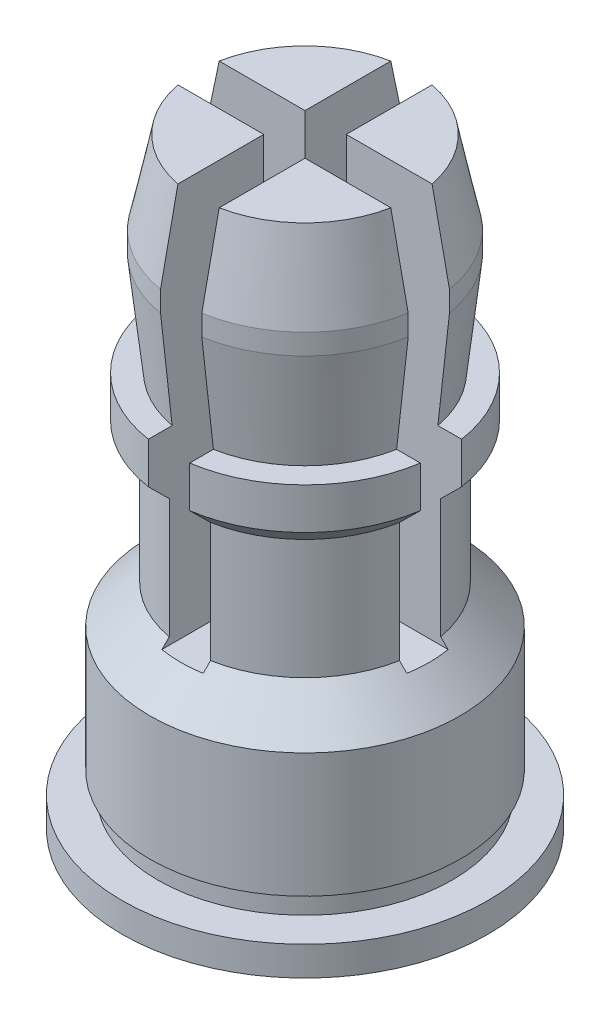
SolidWorks part; units mm, degrees
revolve "Body" add sketch "BodySke" angle 360 about L9
sketch "BodySke" plane through (0, 0, 0) normal (0, 0, 1) x (1, 0, 0)
  line L0 (2.5578, 0.508) -> (2.5578, 0.889)
  line L1 (2.6924, 3.0434) -> (2.0295, 3.7064)
  line L3 (2.0295, 3.7064) -> (2.0295, 5.7836)
  line L4 (0, 0) -> (3.175, 0)
  line L5 (3.175, 0) -> (3.175, 0.508)
  line L6 (3.175, 0.508) -> (2.5578, 0.508)
  line L7 (2.3876, 6.1417) -> (2.3876, 6.858)
  line L8 (2.6924, 0.889) -> (2.6924, 3.0434)
  line L9 (0, 0) -> (0, 17.145) construction
  line L10 (2.3876, 6.858) -> (1.9812, 6.858)
  line L11 (1.9812, 6.858) -> (2.1793, 8.6487)
  line L12 (2.1793, 8.6487) -> (2.1793, 9.0068)
  line L13 (2.1793, 9.0068) -> (1.8821, 10.4394)
  line L14 (1.8821, 10.4394) -> (0, 10.4394)
  line L15 (2.5578, 0.889) -> (2.6924, 0.889)
  line L17 (0, 10.4394) -> (0, 0)
  line L19 (2.3876, 6.1417) -> (2.0295, 5.7836)
ref_plane "Plane1" through (0, 0, 0) normal (0, 0, 1) x (1, 0, 0)
ref_plane "Plane2" through (0, 0, 0) normal (0, 1, 0) x (1, 0, 0)
ref_plane "Plane3" through (0, 0, 0) normal (1, 0, 0) x (0, 0, -1)
other "Configuration Table"
sketch "SlitCutSke" plane through (0, 10.4394, 0) normal (0, 1, 0) x (-1, 0, 0)
  line L0 (-2.6685, 0.3581) -> (2.6685, 0.3581)
  line L1 (2.6685, -0.3581) -> (-2.6685, -0.3581)
  line L2 (-2.6685, 0.3581) -> (-2.6685, -0.3581)
  line L3 (2.6685, 0.3581) -> (2.6685, -0.3581)
  line L4 (-4.064, 0) -> (4.064, 0) construction
  circle A1 centre (0, 0) radius 2.6924 construction
extrude "SlitCut" cut sketch "SlitCutSke" against normal blind 6.86
pattern_circular "SlitCutPat" count 2 every 90 about axis through (0, 0, 0) along (0, 1, 0) of "SlitCut"
ref_plane "Plane4" through (0, -0.5486, 0) normal (0, 1, 0) x (-1, 0, 0)
equation "' \"Panel_dia@BodySke\" = 0.156"
equation "' \"Length@BodySke\" = 0.25"
equation "' \"B_dia@BodySke\" = 0.188"
equation "' \"C_dia@BodySke\" = 0.212"
equation "' \"D_ht@BodySke\" = 0.141"
equation "' \"H_dia@BodySke\" = 0.25"
equation "' \"T_ht@BodySke\" = 0.02"
equation "\"Tip_dia@BodySke\" = \"Panel_dia@BodySke\" * 0.95"
equation "\"Slip_dia@BodySke\" = \"Panel_dia@BodySke\" * 1.1"
equation "\"Slip_ht@BodySke\" = \"D_ht@BodySke\" * 0.1"
equation "\"Grip_ht@BodySke\" = \"D_ht@BodySke\" * 0.5"
equation "\"B_ht@BodySke\" = \"B_dia@BodySke\" * 0.15"
equation "\"Neck_dia@BodySke\" = \"B_dia@BodySke\" * 0.85"
equation "\"Neck_len@BodySke\" = \"B_dia@BodySke\" * 0.66"
equation "\"Groove_dia@BodySke\" = \"C_dia@BodySke\" * 0.95"
equation "\"Groove_wid@BodySke\" = \"T_ht@BodySke\" * 0.75"
equation "\"Width@SlitCutSke\" = \"B_ht@BodySke\""
equation "\"Depth@SlitCut\" = \"D_ht@BodySke\" + \"Neck_len@BodySke\" + 0.005"
